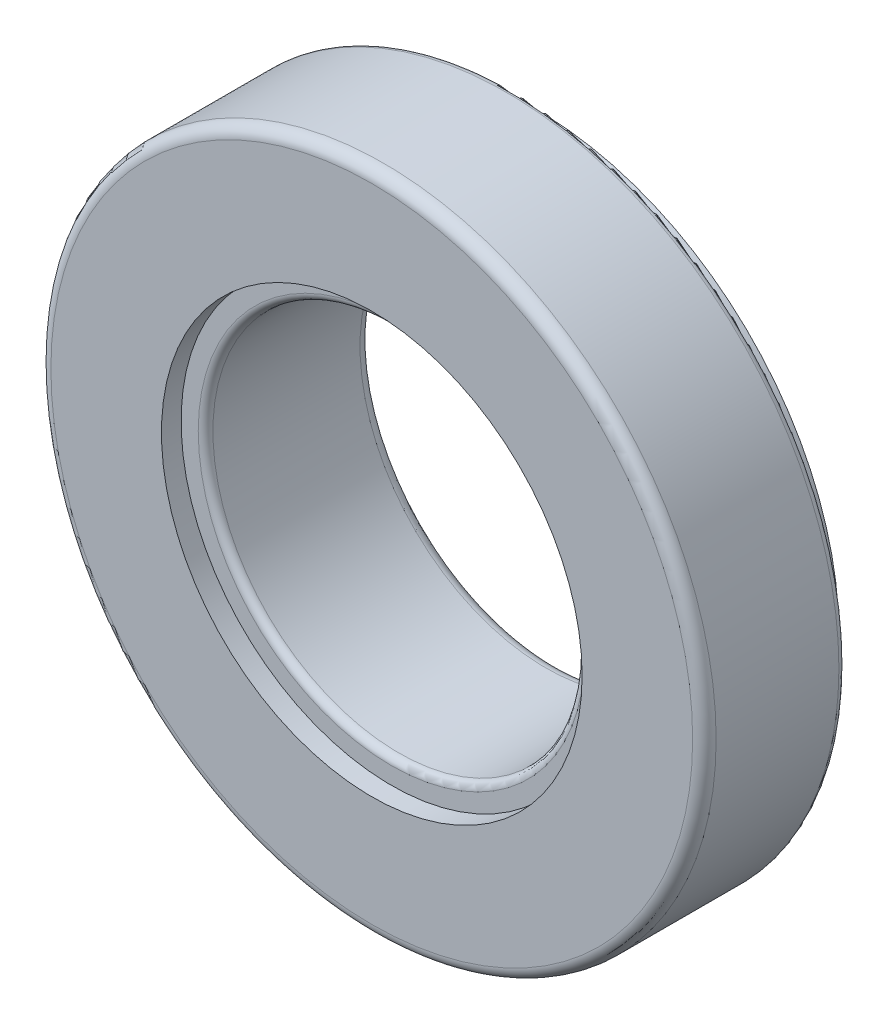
SolidWorks part; units mm, degrees
ref_plane "Face" through (0, 0, 0) normal (0, 0, 1) x (1, 0, 0)
ref_plane "Dessus" through (0, 0, 0) normal (0, 1, 0) x (1, 0, 0)
ref_plane "Droite" through (0, 0, 0) normal (1, 0, 0) x (0, 0, -1)
sketch "E_corps" plane through (0, 0, 0) normal (1, 0, 0) x (0, 0, -1)
  line L0 (-59.9913, 0) -> (114.6539, 0) construction
  line L1 (2.76, 19) -> (17.8, 19)
  line L2 (19, 20.2) -> (19, 27.1)
  line L3 (19, 27.1) -> (16.75, 27.1)
  line L4 (16.75, 27.1) -> (16.75, 31)
  line L5 (16.75, 31) -> (14.5, 30.7028)
  line L6 (14.5, 30.7028) -> (14.5, 33.25)
  line L7 (2.01, 19.75) -> (2.01, 21.5)
  line L8 (2.01, 21.5) -> (0, 21.5)
  line L9 (0, 21.5) -> (0, 32.8)
  line L10 (1.2, 34) -> (13.75, 34)
  line L11 (-1.4825, 109.6532) -> (19.5752, -49.784) construction
  line L12 (0, 50) -> (0, -50) construction
  line L13 (9.5, 134.2783) -> (9.5, -52.9463) construction
  line L14 (-51.6303, 26.5) -> (132.2269, 26.5) construction
  arc A0 (19, 20.2) -> (17.8, 19) centre (17.8, 20.2) cw
  arc A1 (2.01, 19.75) -> (2.76, 19) centre (2.76, 19.75) ccw
  arc A2 (1.2, 34) -> (0, 32.8) centre (1.2, 32.8) ccw
  arc A3 (14.5, 33.25) -> (13.75, 34) centre (13.75, 33.25) ccw
  point P23 (13, 0)
  point P30 (9.5, 26.5)
  dimension "Rayon_appui_bi" = 1.2
  dimension "Rayon" = 0.75
  dimension "Rayon_appui_be" = 1.2
  dimension "Rayon2" = 0.75
  dimension "Diamètre_nominal" = 38
  dimension "Diamètre_extérieur" = 68
  dimension "Largeur_bi" = 16.99
  dimension "Largeur_be" = 14.5
  dimension "Largeur_tot" = 19
  dimension "D6" = 2.25
  dimension "a" = 13
  dimension "d1" = 54.2
  dimension "da_max" = 43
  dimension "D5" = 12
revolve "Corps" add sketch "E_corps" angle 360 about L0
sketch "E_symbole1" plane through (0, 0, 0) normal (1, 0, 0) x (0, 0, -1)
  line L0 (61.8671, 36.9589) -> (-31.539, 24.6222) construction
  line L1 (16.75, 31) -> (14.5, 30.7028) construction
  line L2 (0.0158, 28.7848) -> (0.0145, 28.7947)
  line L3 (0.0145, 28.7947) -> (14.4842, 30.7058)
  line L4 (0.0158, 28.7848) -> (14.4855, 30.6959)
  line L5 (14.4842, 30.7058) -> (14.4855, 30.6959)
  line L6 (0, 21.5) -> (0, 32.8) construction
  line L7 (14.5, 30.7028) -> (14.5, 33.25) construction
  line L8 (-40.1229, 0) -> (90.0965, 0) construction
  line L9 (-59.9913, 0) -> (114.6539, 0) construction
  point P7 (0.0152, 28.7897)
  point P10 (14.4848, 30.7008)
  dimension "D1" = 0.01
  dimension "D2" = 0.0145
  dimension "D3" = 0.0145
revolve "Symbole1" cut sketch "E_symbole1" angle 360 about L8
sketch "E_sybole2" plane through (0, 0, 0) normal (1, 0, 0) x (0, 0, -1)
  line L0 (-18.9008, 22.5139) -> (86.8609, 36.4824) construction
  line L1 (61.8671, 36.9589) -> (-31.539, 24.6222) construction
  line L2 (0.0145, 28.7947) -> (14.4842, 30.7058) construction
  line L3 (9.5, 75.5839) -> (9.5, 12.4558) construction
  line L4 (-18.897, 0) -> (91.6132, 0) construction
  line L5 (0, 21.5) -> (0, 32.8) construction
  line L6 (2.678, 77.917) -> (13.8122, -6.3843) construction
  line L7 (-59.9913, 0) -> (114.6539, 0) construction
  line L8 (13.0931, 26.7445) -> (5.9056, 25.7952)
  line L9 (13.0944, 26.7346) -> (5.9069, 25.7853)
  line L10 (5.9056, 25.7952) -> (5.9069, 25.7853)
  line L11 (13.0931, 26.7445) -> (13.0944, 26.7346)
  point P12 (9.5, 26.2649)
  point P20 (5.9062, 25.7903)
  point P21 (9.5007, 26.26)
  point P22 (9.4993, 26.2699)
  dimension "D1" = 3.75
  dimension "D2" = 9.5
  dimension "D3" = 0.01
  dimension "D4" = 7.25
revolve "Symbole2" cut sketch "E_sybole2" angle 360 about L4
equation "\"Rayon2@E_corps\"=\"Rayon@E_corps\""
equation "\"D5@E_corps\" = (2/3)*( ( \"Diamètre_extérieur@E_corps\" - \"Diamètre_nominal@E_corps\" )  / 2 ) *1.2"
equation "\"D3@E_symbole1\" = 0.001*\"Largeur_be@E_corps\""
equation "\"D2@E_symbole1\" = \"D3@E_symbole1\""
equation "\"D1@E_sybole2\" =  ( 1 / 4 )  *  (  ( \"Diamètre_extérieur@E_corps\" - \"Diamètre_nominal@E_corps\" )  / 2 ) "
equation "\"D4@E_sybole2\" = 0.5*\"Largeur_be@E_corps\""
equation "\"D2@E_sybole2\" =0.5* \"Largeur_tot@E_corps\""
equation "\"D6@E_corps\" =  ( \"Largeur_tot@E_corps\" - \"Largeur_be@E_corps\" )  / 2"
